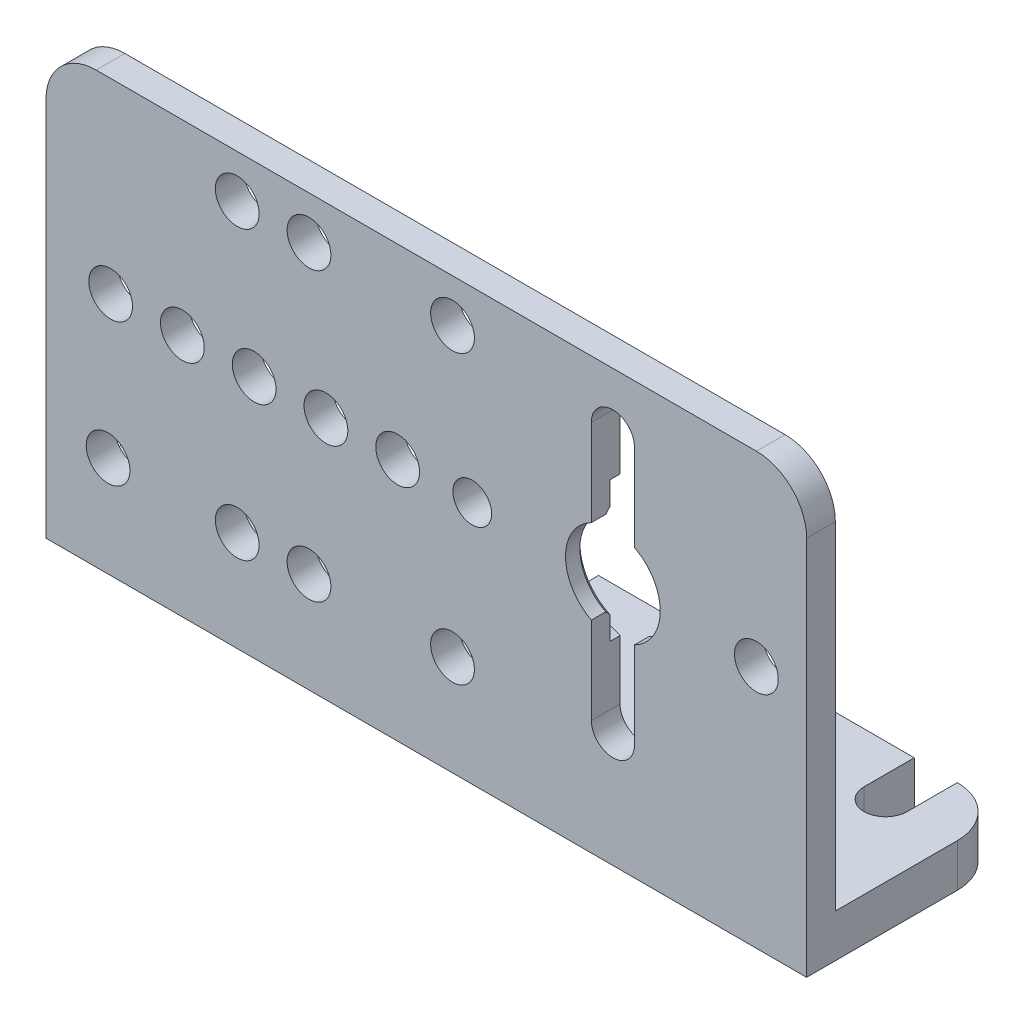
SolidWorks part; units mm, degrees
ref_plane "Plan de face" through (0, 0, 0) normal (0, 0, 1) x (1, 0, 0)
ref_plane "Plan de dessus" through (0, 0, 0) normal (0, 1, 0) x (1, 0, 0)
ref_plane "Plan de droite" through (0, 0, 0) normal (1, 0, 0) x (0, 0, -1)
sketch "Esquisse1" plane through (0, 0, 0) normal (1, 0, 0) x (0, 0, -1)
  line L0 (0, 0) -> (14, 0)
  line L1 (14, 0) -> (14, 3)
  line L2 (14, 3) -> (2, 3)
  line L3 (2, 3) -> (2, 30)
  line L4 (2, 30) -> (0, 30)
  line L5 (0, 30) -> (0, 0)
  dimension "D1" = 3
  dimension "D2" = 2
  dimension "D3" = 30
  dimension "D4" = 14
extrude "Extrusion1" add sketch "Esquisse1" along normal mid plane 53
fillet "Congé1" radius 3.5 4 edges at (-26.5, 1.5, -14) (26.5, 1.5, -14) (26.5, 30, -1) (-26.5, 30, -1)
sketch "Esquisse3" plane through (0, 3, 0) normal (0, 1, 0) x (1, 0, 0)
  line L0 (0, 0) -> (0, 14) construction
  line L1 (23, 14) -> (-23, 14) construction
  line L2 (-26.5, 2) -> (-26.5, 10.5) construction
  line L3 (-20, 14) -> (-17, 14)
  line L4 (-20, 14) -> (-20, 10.5)
  line L5 (-5, 14) -> (-2, 14)
  line L6 (-17, 14) -> (-17, 10.5)
  line L7 (-5, 14) -> (-5, 10.5)
  line L8 (-2, 14) -> (-2, 10.5)
  line L9 (20, 14) -> (23, 14)
  line L10 (20, 14) -> (20, 10.5)
  line L11 (23, 14) -> (23, 10.5)
  arc A0 (-5, 10.5) -> (-2, 10.5) centre (-3.5, 10.5) ccw
  arc A1 (20, 10.5) -> (23, 10.5) centre (21.5, 10.5) ccw
  arc A3 (-17, 10.5) -> (-20, 10.5) centre (-18.5, 10.5) cw
  arc A5 (-17, 10.5) -> (-20, 10.5) centre (-18.5, 10.5) ccw
  arc A6 (-17, 10.5) -> (-20, 10.5) centre (-18.5, 10.5) ccw
  arc A7 (-2, 10.5) -> (-5, 10.5) centre (-3.5, 10.5) ccw
  arc A8 (23, 10.5) -> (20, 10.5) centre (21.5, 10.5) ccw
  dimension "D3" = 3.5
  dimension "D1" = 6.5
  dimension "D2" = 3
extrude "Enlèv. mat.-Extru.1" cut sketch "Esquisse3" against normal through all
sketch "Esquisse4" plane through (0, 0, -2) normal (0, 0, -1) x (-1, 0, 0)
  line L0 (26.5, 17) -> (-26.5, 17) construction
  line L1 (26.5, 26.5) -> (26.5, 3) construction
  line L2 (-26.5, 26.5) -> (-26.5, 3) construction
  line L3 (-23, 30) -> (23, 30) construction
  line L4 (26.5, 27) -> (-26.5, 27) construction
  line L5 (26.5, 7) -> (-26.5, 7) construction
  line L6 (13.1746, 7) -> (22.1746, 7) construction
  line L7 (17, 0) -> (5, 0) construction
  line L8 (-23, 30) -> (23, 30) construction
  line L9 (-13, 30) -> (-13, 0) construction
  line L10 (-14.5, 14.0606) -> (-14.5, 8)
  line L11 (-11.5, 14.0606) -> (-11.5, 8)
  line L12 (-14.5, 26) -> (-14.5, 19.9394)
  line L13 (-26.5, 3) -> (-26.5, 26.5) construction
  line L14 (-11.5, 26) -> (-11.5, 19.9394)
  circle A0 centre (1.9957, 17) radius 1.525
  arc A1 (-24.7499, 26.3173) -> (-24.7283, 26.3444) centre (-13, 17) ccw construction
  circle A2 centre (-1.8254, 7) radius 1.525
  circle A3 centre (8.1746, 7) radius 1.525
  circle A4 centre (8.1746, 27) radius 1.525
  circle A5 centre (6.9957, 17) radius 1.525
  circle A6 centre (11.9957, 17) radius 1.525
  circle A7 centre (16.9957, 17) radius 1.525
  circle A8 centre (-23, 17) radius 1.525
  circle A9 centre (-1.8254, 27) radius 1.525
  circle A10 centre (21.9957, 17) radius 1.525
  circle A11 centre (13.1746, 7) radius 1.525
  circle A12 centre (13.1746, 27) radius 1.525
  circle A13 centre (22.1746, 7) radius 1.525
  circle A15 centre (-3.2, 17) radius 1.35
  arc A16 (-11.5, 26) -> (-14.5, 26) centre (-13, 26) ccw
  arc A17 (-14.5, 8) -> (-11.5, 8) centre (-13, 8) ccw
  arc A18 (-14.5, 19.9394) -> (-14.5, 14.0606) centre (-13, 17) ccw
  arc A19 (-11.5, 14.0606) -> (-11.5, 19.9394) centre (-13, 17) ccw
  dimension "D4" = 3.05
  dimension "D10" = 2.7
  dimension "D14" = 18
  dimension "D15" = 3.3
  dimension "D5" = 9
  dimension "D8" = 5
  dimension "D16" = 14.9957
  dimension "D7" = 10
  dimension "D11" = 5
  dimension "D2" = 10
  dimension "D3" = 10
  dimension "D6" = 9.8
  dimension "D9" = 3.5
  dimension "D12" = 13.5
  dimension "D13" = 3
  dimension "D17" = 13
extrude "Enlèv. mat.-Extru.2" cut sketch "Esquisse4" against normal through all
sketch "Esquisse5" plane through (0, 0, -2) normal (0, 0, -1) x (-1, 0, 0)
  circle A0 centre (-13, 17) radius 5.1
  dimension "D1" = 10.2
extrude "Enlèv. mat.-Extru.3" cut sketch "Esquisse5" against normal blind 0.7
chamfer "Chanfrein1" distance 0.3 angle 45 2 edges at (9.7, 17, -1.3) (16.3, 17, -1.3)
